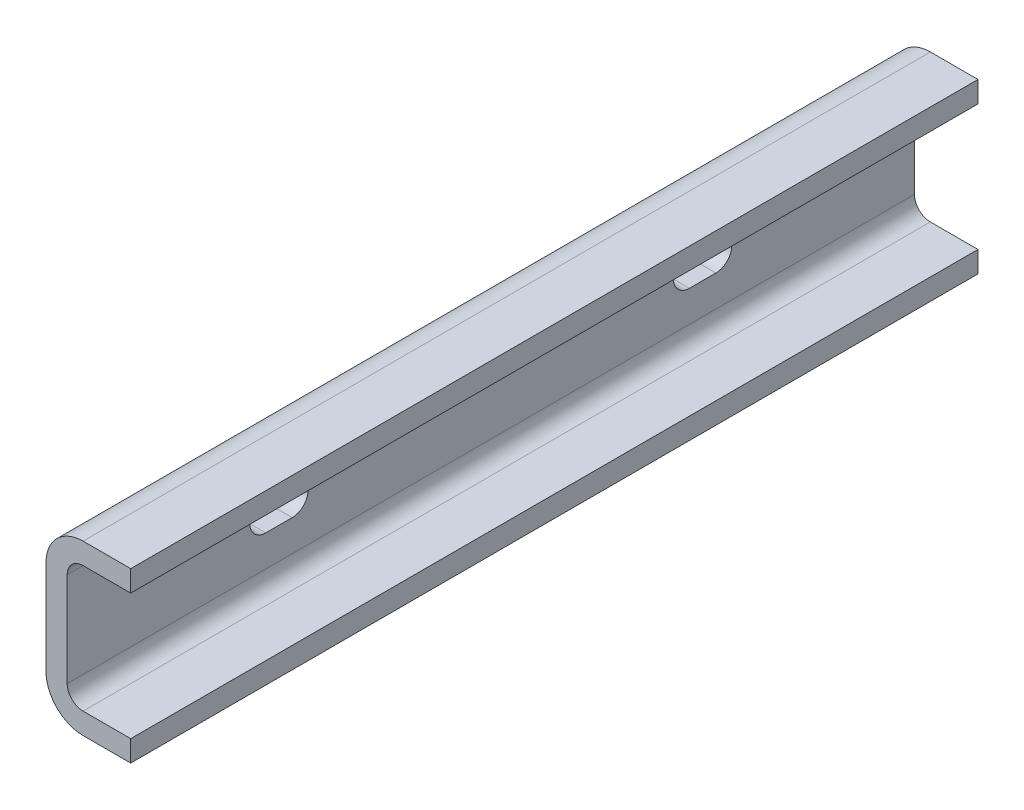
SolidWorks part; units mm, degrees
ref_plane "Front Plane" through (0, 0, 0) normal (0, 0, 1) x (1, 0, 0)
ref_plane "Top Plane" through (0, 0, 0) normal (0, 1, 0) x (1, 0, 0)
ref_plane "Right Plane" through (0, 0, 0) normal (1, 0, 0) x (0, 0, -1)
sketch "Sketch1" plane through (0, 0, 0) normal (0, 0, 1) x (1, 0, 0)
  line L0 (16, 11.9) -> (16, 15.9)
  line L1 (16, 15.9) -> (7, 15.9)
  line L2 (0, 8.9) -> (0, -8.9)
  line L3 (7, -15.9) -> (16, -15.9)
  line L4 (16, -15.9) -> (16, -11.9)
  line L5 (16, -11.9) -> (7, -11.9)
  line L6 (4, -8.9) -> (4, 8.9)
  line L7 (7, 11.9) -> (16, 11.9)
  arc A0 (7, 15.9) -> (0, 8.9) centre (7, 8.9) ccw
  arc A1 (0, -8.9) -> (7, -15.9) centre (7, -8.9) ccw
  arc A2 (7, -11.9) -> (4, -8.9) centre (7, -8.9) cw
  arc A3 (4, 8.9) -> (7, 11.9) centre (7, 8.9) cw
  dimension "D1" = 7
  dimension "D2" = 3
  dimension "D3" = 16
  dimension "D4" = 11.9
  dimension "D5" = 11.9
extrude "Extrude1" add sketch "Sketch1" against normal blind 160
sketch "Sketch2" plane through (4, 0, 0) normal (1, 0, 0) x (0, 0, -1)
  line L0 (37.5, 0) -> (42.5, 0) construction
  line L1 (37.5, 3) -> (42.5, 3)
  line L2 (37.5, -3) -> (42.5, -3)
  arc A0 (37.5, 3) -> (37.5, -3) centre (37.5, 0) ccw
  arc A1 (42.5, 3) -> (42.5, -3) centre (42.5, 0) cw
  point P7 (40, 0)
  dimension "D1" = 5
  dimension "D2" = 6
  dimension "D3" = 40
extrude "Extrude2" cut sketch "Sketch2" against normal through all
pattern_linear "LPattern1" count 2 spacing 80 along (0, 0, -1) of "Extrude2"
